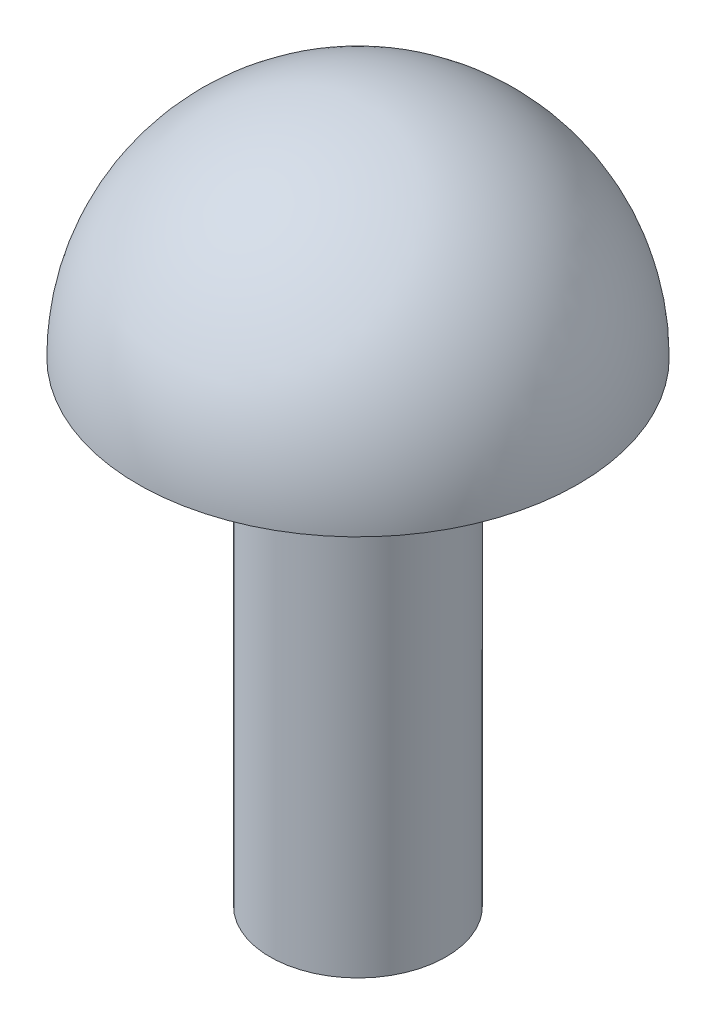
SolidWorks part; units mm, degrees
ref_plane "Front Plane" through (0, 0, 0) normal (0, 0, 1) x (1, 0, 0)
ref_plane "Top Plane" through (0, 0, 0) normal (0, 1, 0) x (1, 0, 0)
ref_plane "Right Plane" through (0, 0, 0) normal (1, 0, 0) x (0, 0, -1)
sketch "Sketch1" plane through (0, 0, 0) normal (0, 0, 1) x (1, 0, 0)
  line L0 (0, 7.9) -> (0, 5.4)
  line L1 (0, 0) -> (1, 0)
  line L2 (0, 0) -> (0, 5)
  line L4 (1, 0) -> (1, 5)
  line L5 (1, 5) -> (2.5, 5.4)
  line L7 (0, 5.4) -> (0, 5)
  arc A0 (2.5, 5.4) -> (0, 7.9) centre (0, 5.4) ccw
  dimension "D3" = 2.5
  dimension "D1" = 1
  dimension "D2" = 5
revolve "Revolve1" add sketch "Sketch1" angle 360 about L2
